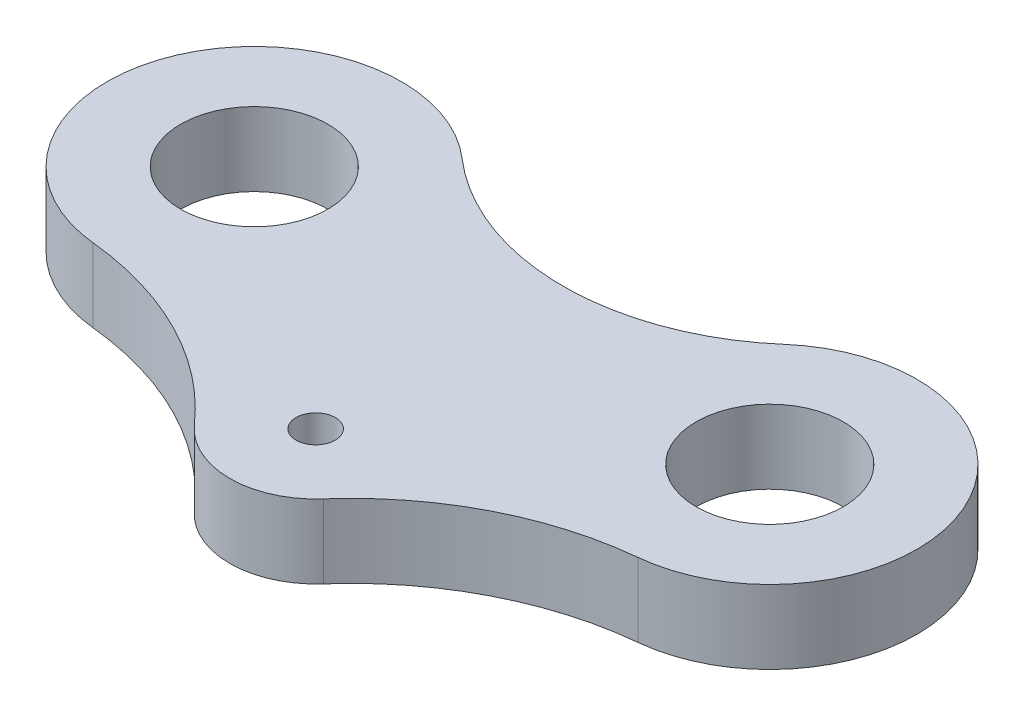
SolidWorks part; units mm, degrees
ref_plane "Alzado" through (0, 0, 0) normal (0, 0, 1) x (1, 0, 0)
ref_plane "Planta" through (0, 0, 0) normal (0, 1, 0) x (1, 0, 0)
ref_plane "Vista lateral" through (0, 0, 0) normal (1, 0, 0) x (0, 0, -1)
sketch "Croquis1" plane through (0, 0, 0) normal (0, 1, 0) x (1, 0, 0)
  line L0 (-52.5, 0) -> (52.5, 0) construction
  line L1 (0, 0) -> (0, -40) construction
  line L2 (0, 0) -> (0, 60.3635) construction
  line L3 (-52.5, 0) -> (0, -40) construction
  circle A0 centre (-52.5, 0) radius 15
  circle A1 centre (52.5, 0) radius 15
  arc A2 (-32.8125, 22.6363) -> (-55.4704, -29.8526) centre (-52.5, 0) ccw
  arc A3 (55.4704, -29.8526) -> (32.8125, 22.6363) centre (52.5, 0) ccw
  circle A4 centre (0, -40) radius 4
  arc A5 (-13.1316, -51.5676) -> (13.1316, -51.5676) centre (0, -40) ccw
  arc A6 (-32.8125, 22.6363) -> (32.8125, 22.6363) centre (0, 60.3635) ccw
  arc A7 (-13.1316, -51.5676) -> (-55.4704, -29.8526) centre (-61.9062, -94.5332) ccw
  arc A8 (55.4704, -29.8526) -> (13.1316, -51.5676) centre (61.9062, -94.5332) ccw
  dimension "D1" = 30
  dimension "D3" = 60
  dimension "D4" = 40
  dimension "D5" = 8
  dimension "D6" = 35
  dimension "D7" = 100
  dimension "D8" = 130
  dimension "D2" = 105
extrude "Saliente-Extruir1" add sketch "Croquis1" along normal blind 15
